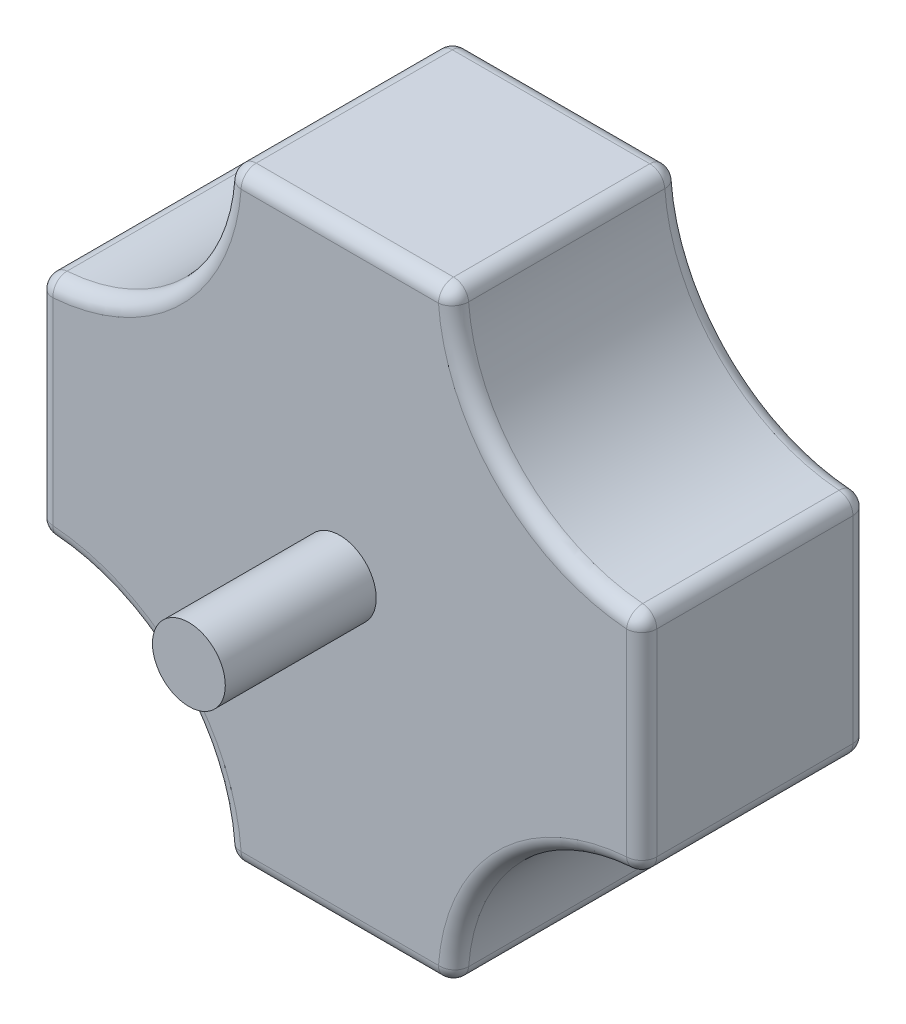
SolidWorks part; units mm, degrees
ref_plane "Front Plane" through (0, 0, 0) normal (0, 0, 1) x (1, 0, 0)
ref_plane "Top Plane" through (0, 0, 0) normal (0, 1, 0) x (1, 0, 0)
ref_plane "Right Plane" through (0, 0, 0) normal (1, 0, 0) x (0, 0, -1)
sketch "Sketch1" plane through (0, 0, 0) normal (0, 0, 1) x (1, 0, 0)
  line L1 (-20, -20) -> (20, -20)
  line L2 (-20, -20) -> (-20, 20)
  line L3 (-20, 20) -> (20, 20)
  line L4 (20, -20) -> (20, 20)
  line L5 (-20, -20) -> (20, 20) construction
  line L6 (-20, 20) -> (20, -20) construction
  point P0 (0, 0)
  dimension "D1" = 40
  dimension "D2" = 40
extrude "Boss-Extrude1" add sketch "Sketch1" along normal blind 15
sketch "Sketch2" plane through (0, 0, 15) normal (0, 0, 1) x (1, 0, 0)
  circle A0 centre (-20, 20) radius 12.5
  circle A1 centre (-20, -20) radius 12.5
  circle A2 centre (20, -20) radius 12.5
  circle A3 centre (20, 20) radius 12.5
extrude "Cut-Extrude1" cut sketch "Sketch2" against normal through all
fillet "Fillet1" radius 1 24 edges at (-7.5, 20, 7.5) (7.5, 20, 7.5) (-20, 7.5, 7.5) (-20, -7.5, 7.5) (20, -7.5, 7.5) (20, 7.5, 7.5) (-7.5, -20, 7.5) (7.5, -20, 7.5) (0, 20, 0) (-11.1612, 11.1612, 0) (-20, 0, 0) (-11.1612, -11.1612, 0) (0, -20, 0) (11.1612, -11.1612, 0) (20, 0, 0) (11.1612, 11.1612, 0) (11.1612, -11.1612, 15) (0, -20, 15) (-11.1612, -11.1612, 15) (-20, 0, 15) (-11.1612, 11.1612, 15) (0, 20, 15) (11.1612, 11.1612, 15) (20, 0, 15)
sketch "Sketch3" plane through (0, 0, 15) normal (0, 0, 1) x (1, 0, 0)
  circle A0 centre (0, 0) radius 2.413
extrude "Boss-Extrude2" add sketch "Sketch3" along normal blind 10
